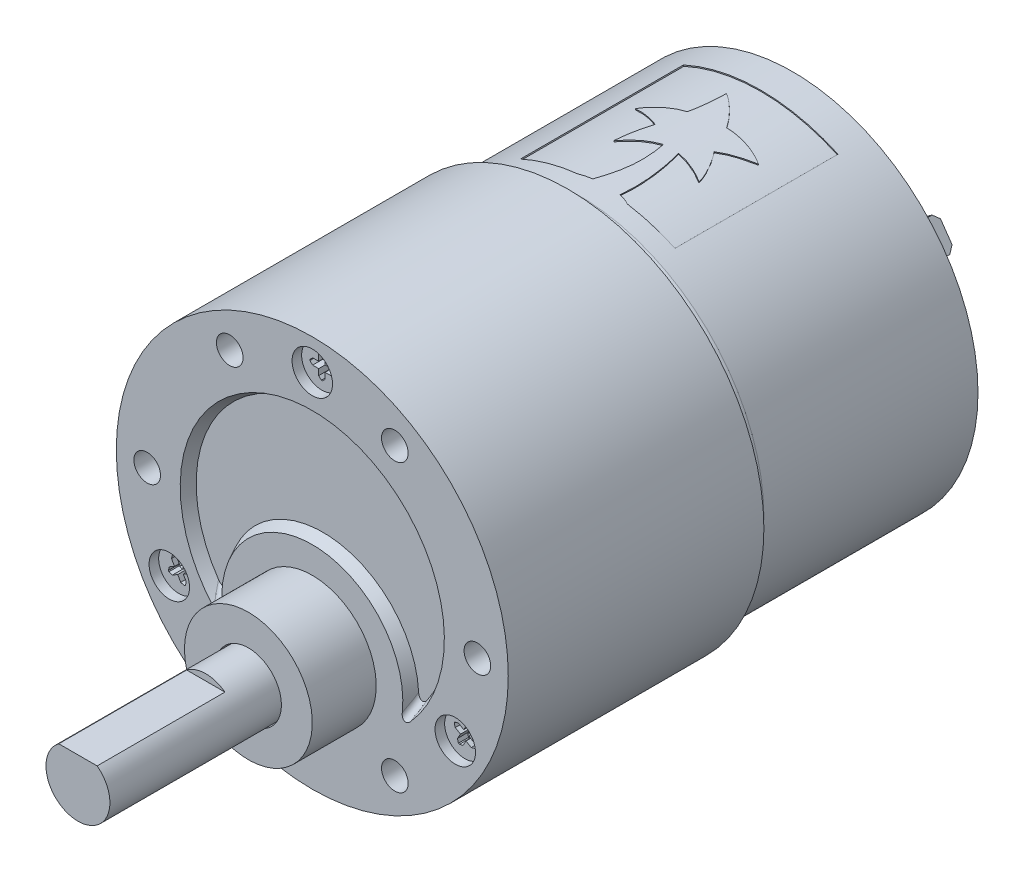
SolidWorks part; units mm, degrees
other "Combine- without encoder"
ref_plane "Ön Düzlem" through (0, 0, 0) normal (0, 0, 1) x (1, 0, 0)
ref_plane "Üst Düzlem" through (0, 0, 0) normal (0, 1, 0) x (1, 0, 0)
ref_plane "Sağ Düzlem" through (0, 0, 0) normal (1, 0, 0) x (0, 0, -1)
imported_body "Alınmış1"
ref_plane "Düzlem1" through (0, 0, -2.875) normal (0, 0, -1) x (-1, 0, 0)
ref_plane "Düzlem2" through (0, 0, -12.475) normal (0, 0, -1) x (-1, 0, 0)
split "Ayır1" trim tools "Düzlem1", "Düzlem2" bodies to split 101 resulting bodies 103 110
move or copy body "Gövde-Taşı/Kopyala1" bodies to move or copy 103 copy no translate (0, 0, 9.6)
combine bodies "Birleştir2" operation type add bodies to combine 120 110
ref_plane "Düzlem3" through (0, 0, 14.325) normal (0, 0, 1) x (1, 0, 0)
split "Ayır2" trim tools "Düzlem3" bodies to split 105 resulting bodies 106 107
move or copy body "Gövde-Taşı/Kopyala2" bodies to move or copy 106 copy no translate (0, 0, 4)
sketch "Çizim3" plane through (0, 0, 18.325) normal (0, 0, -1) x (-1, 0, 0)
  circle A1 centre (-19.925, 0) radius 18.4
  circle A2 centre (-19.925, 0) radius 18.4
  dimension "D1" = 0
extrude "Yükseklik-Ekstrüzyon1" add sketch "Çizim3" along normal up to next
sketch "Çizim4" plane through (0, 0, 30.425) normal (0, 0, 1) x (1, 0, 0)
  circle A0 centre (19.925, -7) radius 3.1
  circle A1 centre (19.925, -7) radius 6
extrude "Kes-Ekstrüzyon1" cut sketch "Çizim4" against normal offset from surface (0.5 mm away) 6
